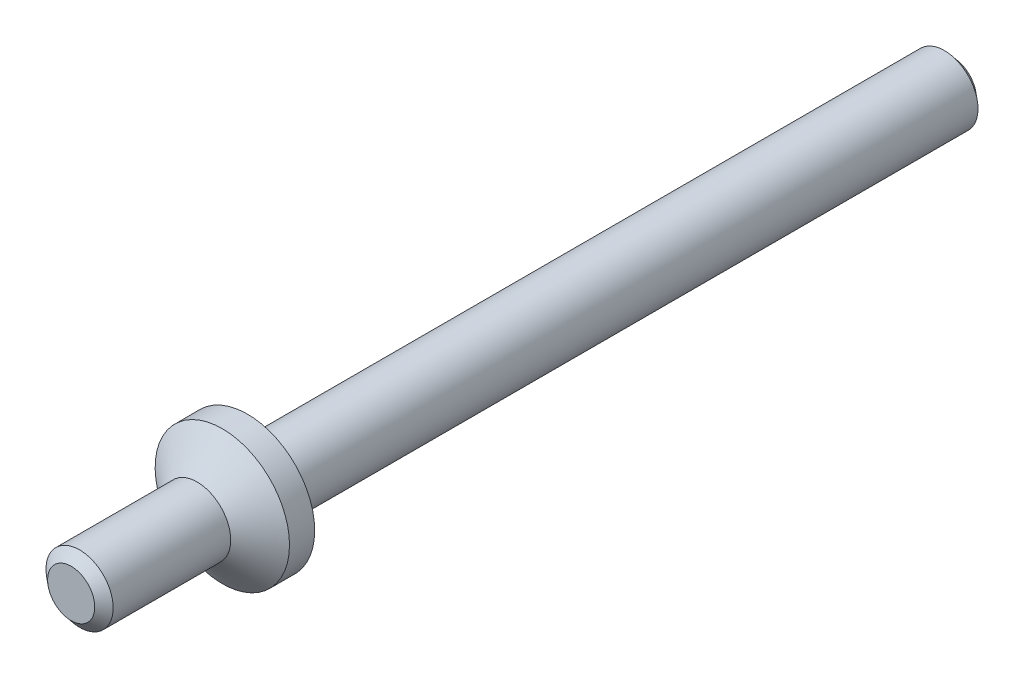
SolidWorks part; units mm, degrees
ref_plane "Front Plane" through (0, 0, 0) normal (0, 0, 1) x (1, 0, 0)
ref_plane "Top Plane" through (0, 0, 0) normal (0, 1, 0) x (1, 0, 0)
ref_plane "Right Plane" through (0, 0, 0) normal (1, 0, 0) x (0, 0, -1)
sketch "Sketch1" plane through (0, 0, 0) normal (0, 0, 1) x (1, 0, 0)
  circle A0 centre (0, 0) radius 8
  dimension "D1" = 16
extrude "Boss-Extrude1" add sketch "Sketch1" against normal blind 3
sketch "Sketch2" plane through (0, 0, -3) normal (0, 0, -1) x (-1, 0, 0)
  circle A0 centre (0, 0) radius 4
  dimension "D1" = 8
extrude "Boss-Extrude2" add sketch "Sketch2" along normal blind 84
ref_plane "Plane1" through (0, 0, 3) normal (0, 0, 1) x (1, 0, 0)
sketch "Sketch4" plane through (0, 0, 3) normal (0, 0, 1) x (1, 0, 0)
  circle A0 centre (0, 0) radius 4
  dimension "D1" = 8
sketch "Sketch5" plane through (0, 0, 0) normal (0, 0, 1) x (1, 0, 0)
  circle A1 centre (0, 0) radius 8
  circle A2 centre (0, 0) radius 8
  dimension "D1" = 0
loft "Loft3" add profiles "Sketch5", "Sketch4"
sketch "Sketch6" plane through (0, 0, 3) normal (0, 0, 1) x (1, 0, 0)
  circle A1 centre (0, 0) radius 4
  circle A2 centre (0, 0) radius 4
  dimension "D1" = 0
extrude "Boss-Extrude3" add sketch "Sketch6" along normal blind 15
chamfer "Chamfer1" distance 1 angle 50 2 edges at (-4, 0, -87) (4, 0, 18)
